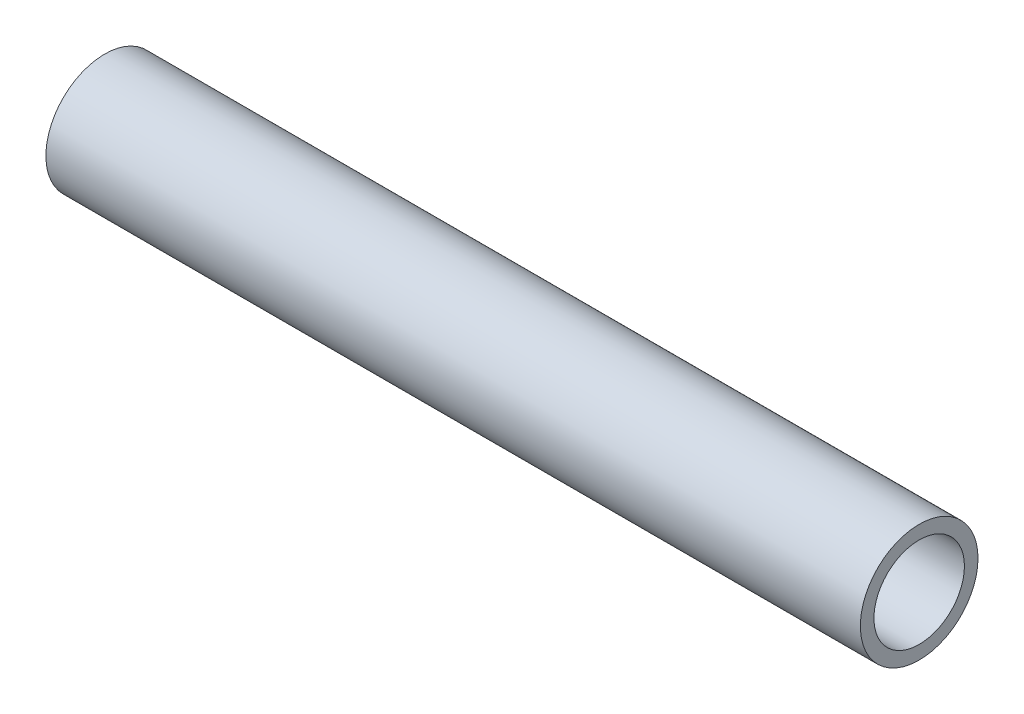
SolidWorks part; units mm, degrees
ref_plane "Front" through (0, 0, 0) normal (0, 0, 1) x (1, 0, 0)
ref_plane "Top" through (0, 0, 0) normal (0, 1, 0) x (1, 0, 0)
ref_plane "Right" through (0, 0, 0) normal (1, 0, 0) x (0, 0, -1)
sketch "Sketch1" plane through (0, 0, 0) normal (0, 0, 1) x (1, 0, 0)
  line L0 (0, 0) -> (228.6, 0)
  line L1 (9.9848, 0) -> (-9.9848, 0) construction
  dimension "D1" = 228.6
other "Structural Member1"
ref_plane "Plane1" through (0, 0, 0) normal (1, 0, 0) x (0, 0, -1)
sketch "Sketch11" plane through (0, 0, 0) normal (1, 0, 0) x (0, 0, -1)
  circle A0 centre (0, 0) radius 12.7
  circle A1 centre (0, 0) radius 16.51
  point P3 (0, 0)
  dimension "D1" = 33.02
  dimension "D2" = 25.4
